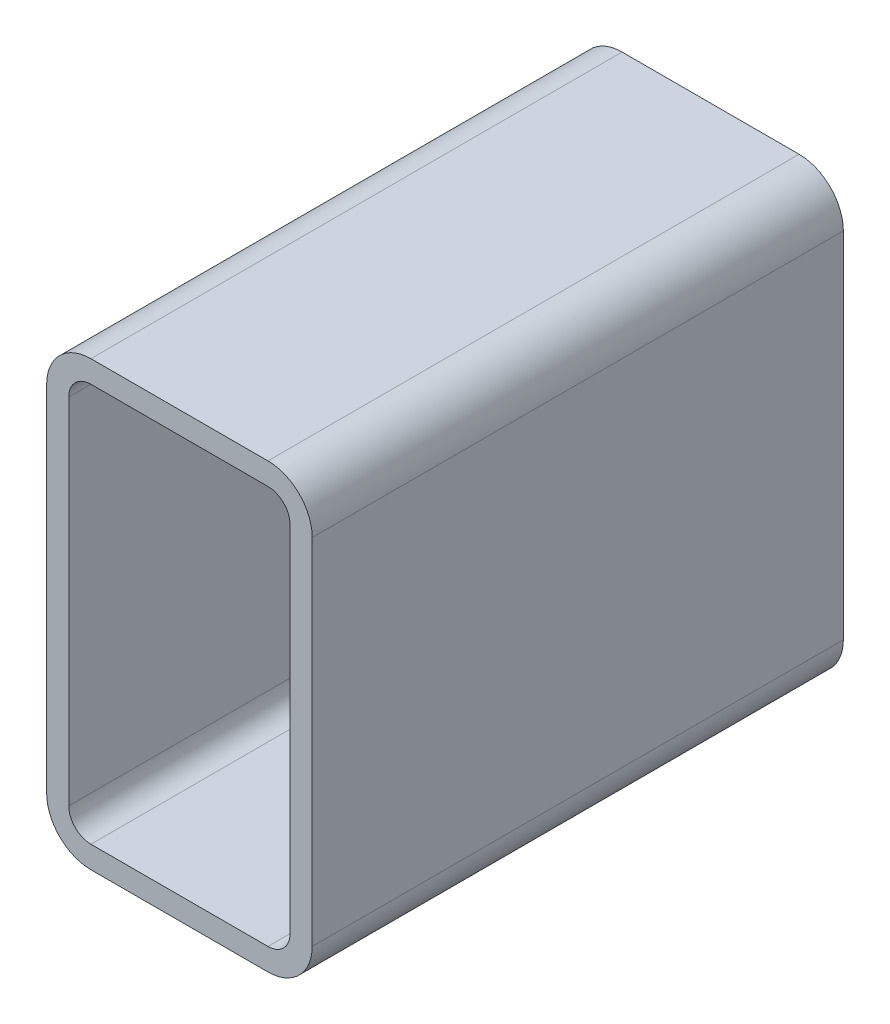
SolidWorks part; units mm, degrees
ref_plane "Front Plane" through (0, 0, 0) normal (0, 0, 1) x (1, 0, 0)
ref_plane "Top Plane" through (0, 0, 0) normal (0, 1, 0) x (1, 0, 0)
ref_plane "Right Plane" through (0, 0, 0) normal (1, 0, 0) x (0, 0, -1)
sketch "Sketch1" plane through (0, 0, 0) normal (0, 0, 1) x (1, 0, 0)
sketch_block_instance "HSS10x6x0.500-1"
sketch_block "HSS10x6x0.500"
extrude "Boss-Extrude1" add sketch "Sketch1" along normal blind 304.8
